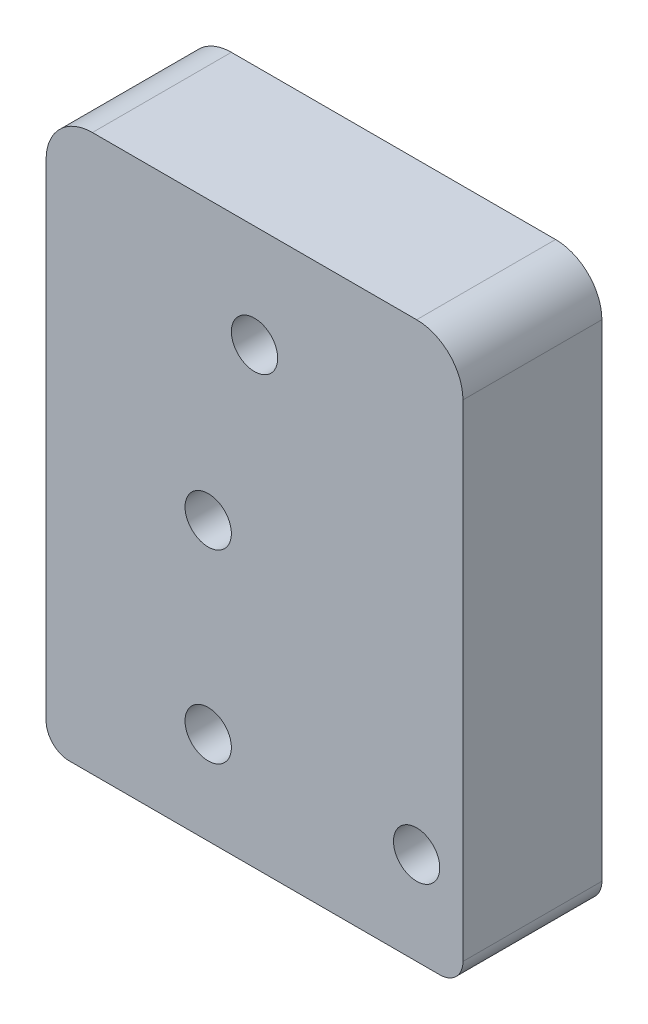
SolidWorks part; units mm, degrees
ref_plane "Front Plane" through (0, 0, 0) normal (0, 0, 1) x (1, 0, 0)
ref_plane "Top Plane" through (0, 0, 0) normal (0, 1, 0) x (1, 0, 0)
ref_plane "Right Plane" through (0, 0, 0) normal (1, 0, 0) x (0, 0, -1)
sketch "Sketch1" plane through (0, 0, 0) normal (0, 0, 1) x (1, 0, 0)
  line L0 (22.225, 0) -> (22.225, 12.7)
  line L1 (3.175, 0) -> (53.975, 0)
  line L2 (0, 3.175) -> (0, 69.85)
  line L3 (6.35, 76.2) -> (50.8, 76.2)
  line L4 (57.15, 3.175) -> (57.15, 69.85)
  line L5 (22.225, 12.7) -> (0, 12.7)
  line L6 (22.225, 12.7) -> (22.225, 38.1)
  line L7 (22.225, 38.1) -> (22.225, 49.3969)
  line L8 (22.225, 49.3969) -> (0, 49.3969)
  line L9 (22.225, 49.3969) -> (57.15, 49.3969)
  line L10 (0, 49.3969) -> (0, 68.4469)
  line L11 (0, 68.4469) -> (57.15, 68.4469)
  line L12 (22.225, 12.7) -> (44.45, 12.7)
  line L13 (44.45, 12.7) -> (44.45, 0)
  line L14 (44.45, 0) -> (57.15, 0)
  line L15 (44.45, 0) -> (57.15, 0)
  line L16 (50.8, 0) -> (50.8, 12.7)
  line L17 (0, 49.3969) -> (0, 68.4469)
  line L18 (0, 49.3969) -> (0, 68.4469)
  line L19 (28.575, 68.4469) -> (28.575, 62.0969)
  line L20 (28.575, 58.9219) -> (28.575, 55.7469)
  circle A0 centre (22.225, 12.7) radius 3.175
  circle A1 centre (22.225, 38.1) radius 3.175
  circle A2 centre (50.8, 12.7) radius 3.175
  circle A3 centre (28.575, 62.0969) radius 3.175
  arc A4 (53.975, 0) -> (57.15, 3.175) centre (53.975, 3.175) ccw
  arc A5 (3.175, 0) -> (0, 3.175) centre (3.175, 3.175) cw
  arc A6 (57.15, 69.85) -> (50.8, 76.2) centre (50.8, 69.85) ccw
  arc A7 (6.35, 76.2) -> (0, 69.85) centre (6.35, 69.85) ccw
  point P31 (0, 0)
  point P36 (0, 76.2)
  dimension "D5" = 3.175
  dimension "D6" = 6.35
  dimension "D1" = 76.2
  dimension "D2" = 57.15
  dimension "D3" = 12.7
  dimension "D4" = 22.225
extrude "Boss-Extrude1" add sketch "Sketch1" along normal blind 19.05
sketch "Sketch3" plane through (0, 0, 0) normal (0, 0, -1) x (-1, 0, 0)
  line L0 (-22.225, 49.3969) -> (0, 49.3969)
  line L1 (0, 49.3969) -> (0, 0)
  line L2 (-22.225, 49.3969) -> (-44.45, 49.3969)
  line L3 (-44.45, 49.3969) -> (-44.45, 0)
  line L4 (-44.45, 0) -> (0, 0)
extrude "Cut-Extrude2" cut sketch "Sketch3" against normal blind 9.525
